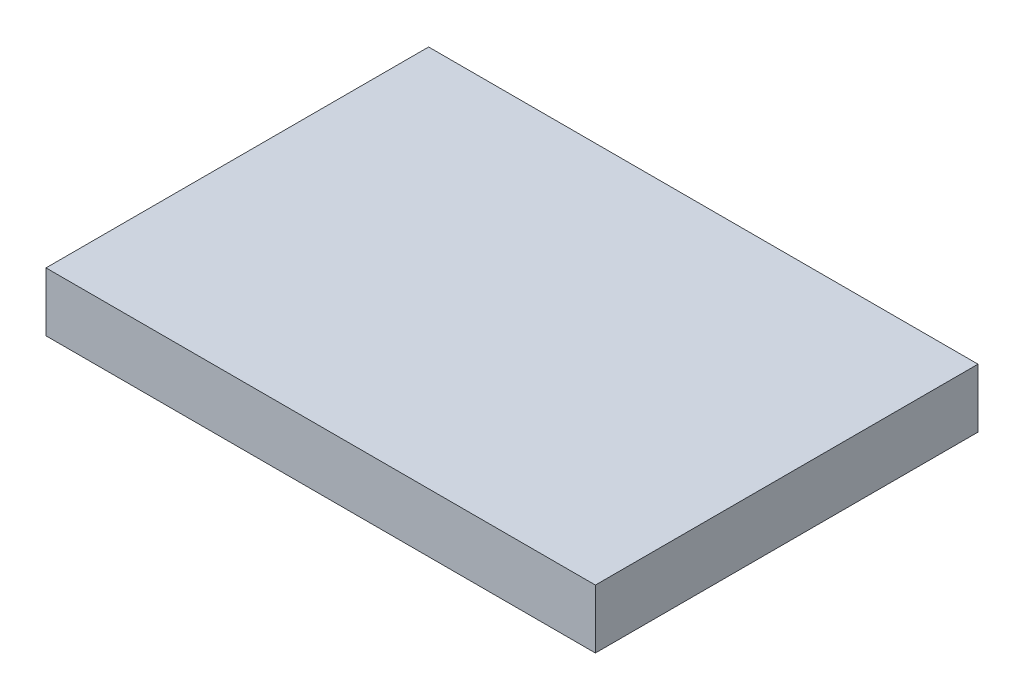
SolidWorks part; units mm, degrees
ref_plane "Front Plane" through (0, 0, 0) normal (0, 0, 1) x (1, 0, 0)
ref_plane "Top Plane" through (0, 0, 0) normal (0, 1, 0) x (1, 0, 0)
ref_plane "Right Plane" through (0, 0, 0) normal (1, 0, 0) x (0, 0, -1)
sketch "Sketch1" plane through (0, 0, 0) normal (0, 1, 0) x (1, 0, 0)
  line L1 (-7.112, -4.953) -> (7.112, -4.953)
  line L2 (-7.112, -4.953) -> (-7.112, 4.953)
  line L3 (-7.112, 4.953) -> (7.112, 4.953)
  line L4 (7.112, -4.953) -> (7.112, 4.953)
  line L5 (-7.112, -4.953) -> (7.112, 4.953) construction
  line L6 (-7.112, 4.953) -> (7.112, -4.953) construction
  point P0 (0, 0)
  dimension "D1" = 14.224
  dimension "D2" = 9.906
sheet metal parameters "Sheet-Metal1" thickness 1.524 parameters "D1"=0.3848
base flange "Base-Flange1" sketch "Sketch1" thickness 1.524 reverse thickness direction no parameters "D1"=0.3848
flat pattern "Flat-Pattern1"
sketch "Bend-Lines1" plane through (0, 0, 0) normal (0, 1, 0) x (1, 0, 0)
sketch3d "Bounding-Box1" [suppressed]
  line L0 (-7.112, 4.953, 0) -> (7.112, 4.953, 0) construction
  line L1 (-7.112, -4.953, 0) -> (7.112, -4.953, 0) construction
  line L2 (-7.112, 4.953, 0) -> (-7.112, -4.953, 0) construction
  line L3 (7.112, 4.953, 0) -> (7.112, -4.953, 0) construction
